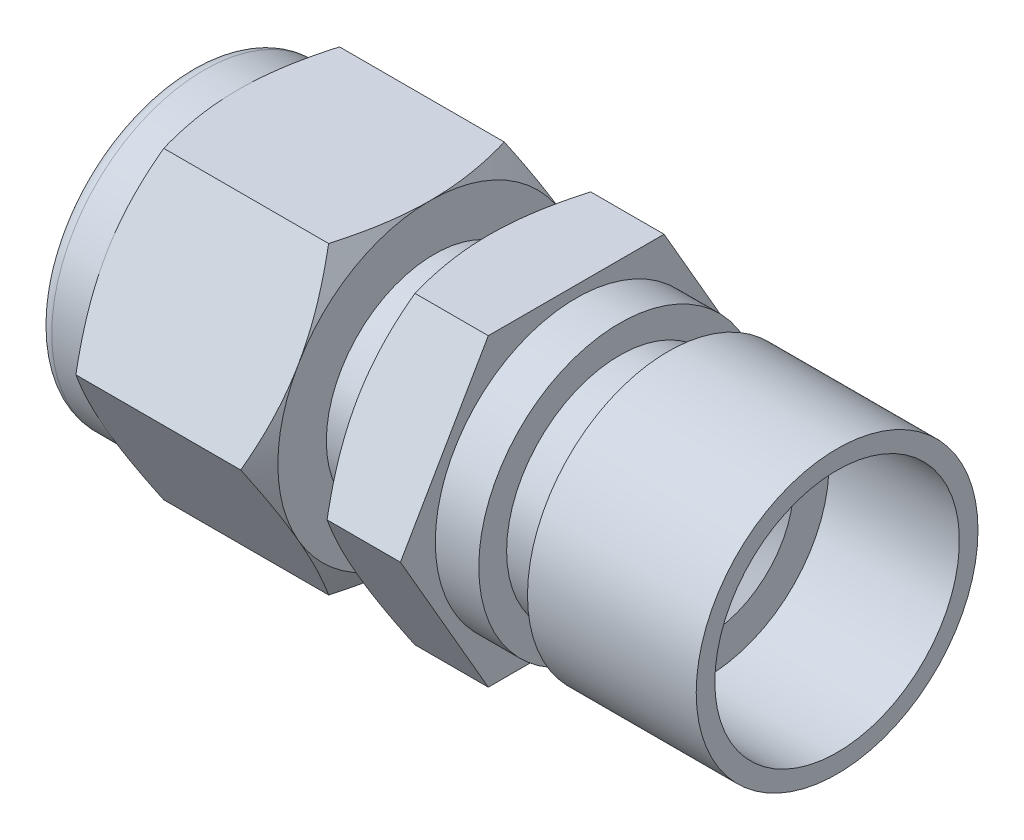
SolidWorks part; units mm, degrees
ref_plane "Front Plane" through (0, 0, 0) normal (0, 0, 1) x (1, 0, 0)
ref_plane "Top Plane" through (0, 0, 0) normal (0, 1, 0) x (1, 0, 0)
ref_plane "Right Plane" through (0, 0, 0) normal (1, 0, 0) x (0, 0, -1)
imported_body "SS-810-1L-8ST"
sketch "Sketch2" plane through (0, 0, 0) normal (0, 0, 1) x (1, 0, 0)
  line L1 (21.844, 11.1125) -> (21.844, 5.5563) construction
  line L2 (28.194, 0) -> (28.194, 15.6567)
  line L3 (28.194, 15.6567) -> (49.022, 15.6567)
  line L4 (49.022, 7.0543) -> (49.022, 15.6567)
  line L6 (0, 0) -> (38.7966, 0) construction
  line L7 (49.022, -5.207) -> (49.022, 5.207) construction
  line L9 (28.194, 0) -> (49.022, 0)
  line L10 (49.022, 7.0543) -> (49.022, 0)
  dimension "D1" = 6.35
revolve "Cut-Revolve1" cut sketch "Sketch2" angle 360 about L6
sketch "Sketch1" plane through (0, 0, 0) normal (0, 0, 1) x (1, 0, 0)
  line L0 (34.925, 10.287) -> (47.244, 10.287)
  line L1 (22.86, 5.1308) -> (36.4998, 5.1308)
  line L2 (21.844, 10.287) -> (21.844, 7.9546)
  line L4 (37.719, 6.35) -> (37.719, 8.9281)
  line L5 (21.844, 0) -> (65.0983, 0) construction
  line L8 (21.844, 10.287) -> (31.369, 10.287)
  line L9 (20.1662, 6.35) -> (22.86, 6.35)
  line L10 (22.86, 6.35) -> (22.86, 5.1308)
  line L12 (65.278, 11.1125) -> (65.278, -11.1125) construction
  line L13 (31.369, 10.287) -> (31.369, 8.255)
  line L14 (31.369, 8.255) -> (34.925, 8.255)
  line L15 (34.925, 10.287) -> (34.925, 8.255)
  line L16 (0, 7.62) -> (0, -7.62) construction
  line L17 (21.844, 11.1125) -> (21.844, -11.1125) construction
  line L18 (21.844, -11.1125) -> (65.278, -11.1125) construction
  line L19 (21.844, 11.1125) -> (65.278, 11.1125) construction
  line L22 (21.844, 7.9546) -> (20.1662, 7.9546)
  line L23 (20.1662, 7.9546) -> (20.1662, 6.35)
  line L24 (20.1662, -7.9546) -> (20.1662, 7.9546) construction
  line L25 (37.719, 8.9281) -> (47.244, 8.9281)
  line L26 (47.244, 8.9281) -> (47.244, 10.287)
  line L31 (36.4998, 5.1308) -> (37.719, 6.35)
  line L32 (0, 10.0965) -> (0, -10.0965) construction
other "AlignGroup3" parameters "D1"=20.193, "D2"=41.1068, "D3"=41.1068, "D4"=38.1, "D5"=41.5901, "D6"=2.4424, "D7"=2.032, "D8"=4.3942, "D9"=4.3942, "D10"=15.24, "D11"=33.3527, "D12"=4.3942, "D13"=10.029, "D14"=22.729, "D15"=32.254, "D16"=38.604, "D17"=12, "D18"=26.6898, "D19"=20.9875, "D20"=22.2074, "D21"=2.6938
revolve "Revolve1" add sketch "Sketch1" angle 360 about L5
